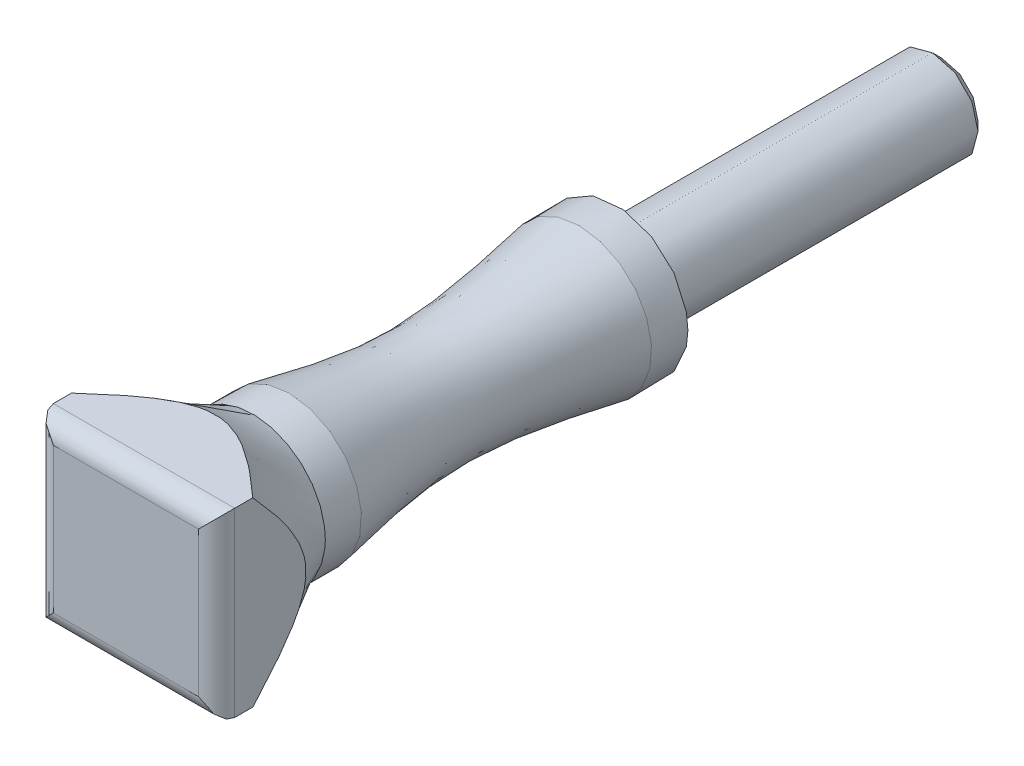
SolidWorks part; units mm, degrees
ref_plane "Plan de face" through (0, 0, 0) normal (0, 0, 1) x (1, 0, 0)
ref_plane "Plan de dessus" through (0, 0, 0) normal (0, 1, 0) x (1, 0, 0)
ref_plane "Plan de droite" through (0, 0, 0) normal (1, 0, 0) x (0, 0, -1)
sketch "Esquisse1" plane through (0, 0, 0) normal (0, 0, 1) x (1, 0, 0)
  circle A0 centre (0, 0) radius 4
  dimension "D1" = 8
extrude "Extrusion1" add sketch "Esquisse1" along normal blind 2
sketch "Esquisse2" plane through (0, 0, 0) normal (1, 0, 0) x (0, 0, -1)
  line L0 (0, 0) -> (-78.5944, 0) construction
  line L1 (0, -4) -> (0, 4) construction
  line L2 (-22, 4) -> (-24, 4)
  line L3 (-24, 4) -> (-24, 0)
  line L4 (-2, 4) -> (-2, -4) construction
  line L5 (-2, 4) -> (-2, 0)
  line L6 (-24, 0) -> (-2, 0)
  spline S0 degree 3 poles (-22, 4) (-19.1023, 3.6018) (-12.446, 2.6869) (-5.7699, 3.5261) (-2, 4) knots 0 0 0 0 0.435327 1 1 1 1
  dimension "D1" = 24
  dimension "D2" = 2
revolve "Révolution2" add sketch "Esquisse2" angle 360 about L0
sketch "Esquisse3" plane through (0, 0, 0) normal (0, 0, -1) x (-1, 0, 0)
  circle A0 centre (0, 0) radius 2.5
  dimension "D1" = 5
extrude "Extrusion2" add sketch "Esquisse3" along normal blind 18
chamfer "Chanfrein1" distance 0.5 angle 45 1 edges at (-2.5, 0, -18)
ref_plane "Plan1" through (0, 0, 32) normal (0, 0, 1) x (1, 0, 0)
sketch "Esquisse4" plane through (0, 0, 32) normal (0, 0, 1) x (1, 0, 0)
  circle A0 centre (0, 0) radius 7.0711
sketch "Esquisse5" plane through (0, 0, 24) normal (0, 0, 1) x (1, 0, 0)
  circle A1 centre (0, 0) radius 4
  circle A2 centre (0, 0) radius 4
  dimension "D1" = 0
loft "Lissage1" add profiles "Esquisse5", "Esquisse4"
sketch "Esquisse6" plane through (0, 0, 32) normal (0, 0, 1) x (1, 0, 0)
  circle A1 centre (0, 0) radius 7.0711
  circle A2 centre (0, 0) radius 7.0711
  dimension "D1" = 0
extrude "Extrusion3" add sketch "Esquisse6" along normal blind 3
sketch "Esquisse7" plane through (0, 0, 35) normal (0, 0, 1) x (1, 0, 0)
  line L1 (5, 5) -> (-5, 5)
  line L2 (5, 5) -> (5, -5)
  line L3 (5, -5) -> (-5, -5)
  line L4 (-5, 5) -> (-5, -5)
  line L5 (13.9071, 11.5835) -> (-11.2391, 11.5835)
  line L6 (13.9071, 11.5835) -> (13.9071, -9.5644)
  line L7 (13.9071, -9.5644) -> (-11.2391, -9.5644)
  line L8 (-11.2391, 11.5835) -> (-11.2391, -9.5644)
  dimension "D1" = 10
  dimension "D2" = 10
  dimension "D3" = 5
  dimension "D4" = 5
extrude "Enlèv. mat.-Extru.1" cut sketch "Esquisse7" against normal through all
fillet "Congé1" radius 1 4 edges at (-5, 0, 35) (0, 5, 35) (5, 0, 35) (0, -5, 35)
